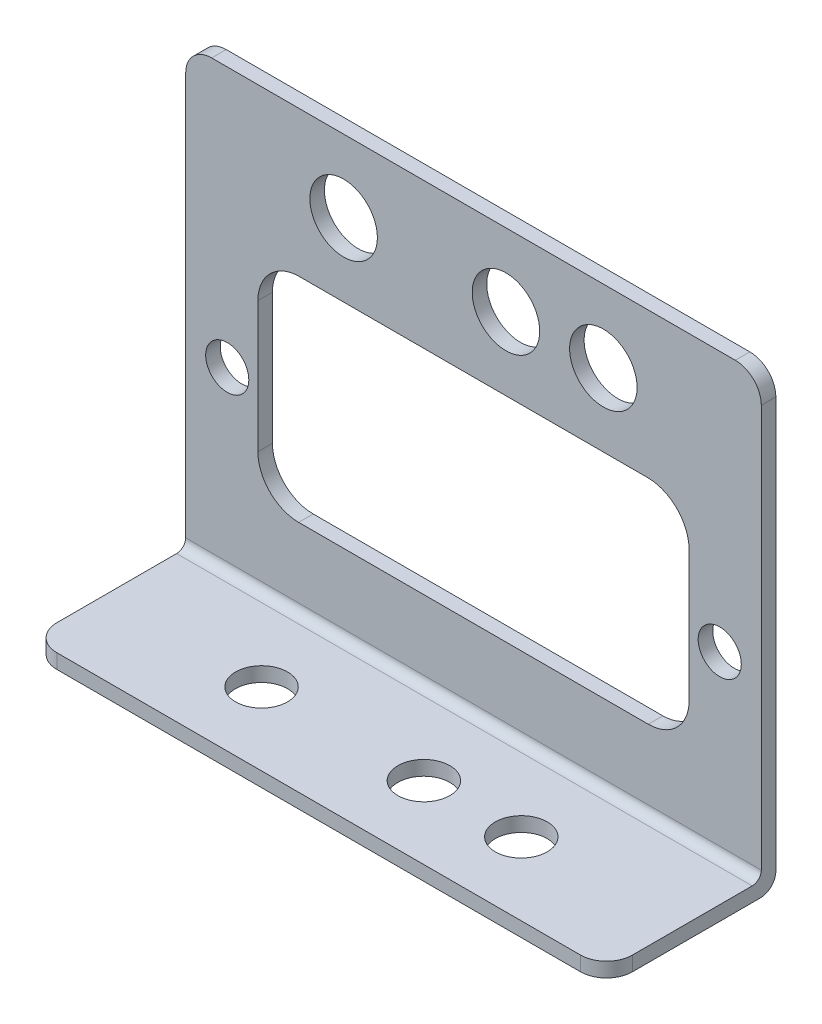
SolidWorks part; units mm, degrees
ref_plane "Front Plane" through (0, 0, 0) normal (0, 0, 1) x (1, 0, 0)
ref_plane "Top Plane" through (0, 0, 0) normal (0, 1, 0) x (1, 0, 0)
ref_plane "Right Plane" through (0, 0, 0) normal (1, 0, 0) x (0, 0, -1)
sketch "Sketch1" plane through (0, 0, 0) normal (1, 0, 0) x (0, 0, -1)
  line L0 (-1.524, 0) -> (-16.5608, 0)
  line L1 (-16.5608, 0) -> (-16.5608, 1.4224)
  line L2 (0, 1.524) -> (0, 44.2214)
  line L3 (0, 44.2214) -> (-1.4224, 44.2214)
  line L4 (-16.5608, 1.4224) -> (-2.3114, 1.4224)
  line L5 (-1.4224, 44.2214) -> (-1.4224, 2.3114)
  arc A0 (-2.3114, 1.4224) -> (-1.4224, 2.3114) centre (-2.3114, 2.3114) ccw
  arc A1 (0, 1.524) -> (-1.524, 0) centre (-1.524, 1.524) cw
  point P11 (0, 0)
  dimension "D1" = 0.889
  dimension "D2" = 1.524
extrude "Boss-Extrude1" add sketch "Sketch1" along normal blind 56.2864
sketch "Sketch2" plane through (0, 0, 1.4224) normal (0, 0, 1) x (1, 0, 0)
  circle A0 centre (4.064, 18.7706) radius 1.9939
  circle A1 centre (52.2224, 18.7706) radius 1.9939
sketch "Sketch3" plane through (0, 1.4224, 0) normal (0, 1, 0) x (1, 0, 0)
  circle A0 centre (15.4432, -9.4488) radius 2.54
  circle A1 centre (40.8432, -9.4488) radius 2.54
  circle A2 centre (31.3182, -9.4488) radius 2.54
extrude "Cut-Extrude2" cut sketch "Sketch3" against normal through all
sketch "Sketch4" plane through (0, 0, 1.4224) normal (0, 0, 1) x (1, 0, 0)
  line L0 (7.0612, 13.1318) -> (7.0612, 25.9334)
  line L2 (28.1432, 9.144) -> (11.049, 9.144)
  line L3 (11.1252, 29.9974) -> (45.1612, 29.9974)
  line L4 (49.2252, 25.9334) -> (49.2252, 13.1318)
  line L6 (45.2374, 9.144) -> (28.1432, 9.144)
  arc A0 (49.2252, 13.1318) -> (45.2374, 9.144) centre (45.2374, 13.1318) cw
  arc A1 (11.049, 9.144) -> (7.0612, 13.1318) centre (11.049, 13.1318) cw
  arc A2 (45.1612, 29.9974) -> (49.2252, 25.9334) centre (45.1612, 25.9334) cw
  arc A3 (11.1252, 29.9974) -> (7.0612, 25.9334) centre (11.1252, 25.9334) ccw
  dimension "D1" = 3.9878
  dimension "D2" = 4.064
extrude "Cut-Extrude3" cut sketch "Sketch4" against normal through all
fillet "Fillet2" radius 2.54 2 edges at (56.2864, 0.7112, 16.5608) (0, 0.7112, 16.5608)
sketch "Sketch6" plane through (0, 0, 1.4224) normal (0, 0, 1) x (1, 0, 0)
  circle A0 centre (4.064, 18.7706) radius 2.1082
  circle A1 centre (52.2224, 18.7706) radius 2.1082
extrude "Cut-Extrude4" cut sketch "Sketch6" against normal through all
sketch "Sketch9" plane through (0, 0, 1.4224) normal (0, 0, 1) x (1, 0, 0)
  circle A0 centre (15.4432, 37.1094) radius 3.302
  circle A1 centre (31.3182, 37.1094) radius 3.302
  circle A2 centre (40.8432, 37.1094) radius 3.302
extrude "Cut-Extrude5" cut sketch "Sketch9" against normal blind 2.54
fillet "Fillet3" radius 2.54 2 edges at (56.2864, 44.2214, 0.7112) (0, 44.2214, 0.7112)
